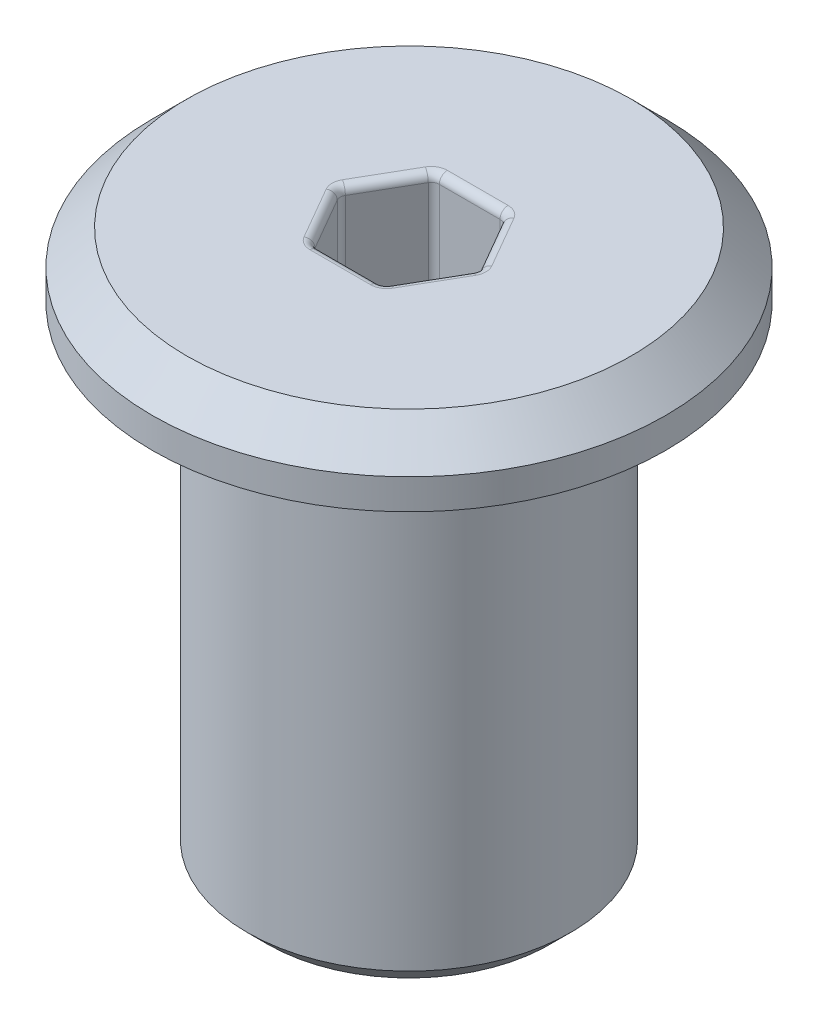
SolidWorks part; units mm, degrees
ref_plane "Plan1" through (0, 0, 0) normal (0, 0, 1) x (1, 0, 0)
ref_plane "Plan2" through (0, 0, 0) normal (0, 1, 0) x (1, 0, 0)
ref_plane "Plan3" through (0, 0, 0) normal (1, 0, 0) x (0, 0, -1)
sketch "Esquisse1" plane through (0, 0, 0) normal (0, 0, 1) x (1, 0, 0)
  line L0 (0, 14.5) -> (0, -8) construction
  line L1 (-6.35, 0) -> (-4, 0)
  line L2 (-6.35, 0) -> (-6.35, 0.75)
  line L3 (-6.35, 0.75) -> (-5.5, 1.6)
  line L4 (-5.5, 1.6) -> (0, 1.6)
  line L5 (-4, 0) -> (-4, -11.5)
  line L6 (-4, -11.5) -> (-3.5, -12)
  line L7 (-3.5, -12) -> (0, -12)
  line L8 (0, -12) -> (0, 1.6)
  line L9 (0, 4.5) -> (0, -15) construction
  dimension "D1" = 6.35
  dimension "D2" = 1.6
  dimension "D3" = 12
  dimension "D4" = 4
  dimension "D5" = 45
  dimension "D6" = 0.75
  dimension "D7" = 45
  dimension "D8" = 0.5
revolve "Vis" add sketch "Esquisse1" angle 360 about L9
sketch "Esquisse2" plane through (0, 1.6, 0) normal (0, 1, 0) x (-1, 0, 0)
  line L0 (-3, 0) -> (2.5, 0) construction
  line L1 (0.866, -1.5) -> (-0.866, -1.5)
  line L2 (0, -3) -> (0, 2) construction
  line L3 (-0.866, -1.5) -> (-1.7321, 0)
  line L4 (0.866, 1.5) -> (-0.866, 1.5)
  line L5 (-0.866, 1.5) -> (-1.7321, 0)
  line L6 (0.866, 1.5) -> (1.7321, 0)
  line L7 (0.866, -1.5) -> (1.7321, 0)
  point P14 (0, 1.5)
  point P15 (0, -1.5)
  dimension "D1" = 60
  dimension "D2" = 1.7321
  dimension "D3" = 1.5
  dimension "D4" = 3
extrude "CHC" cut sketch "Esquisse2" against normal blind 5
fillet "Congé1" radius 0.2
